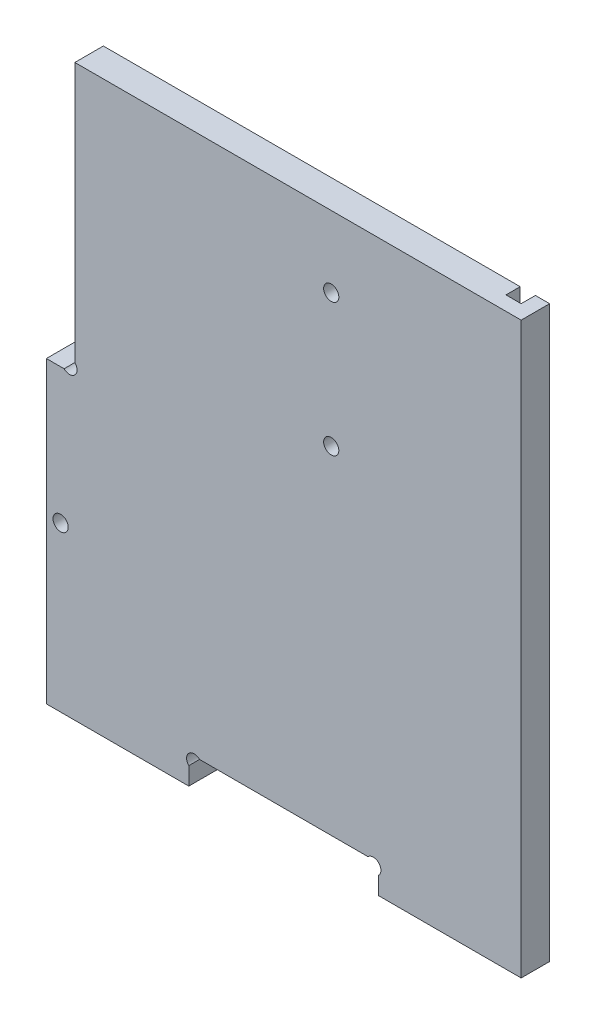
SolidWorks part; units mm, degrees
ref_plane "Plan de face" through (0, 0, 0) normal (0, 0, 1) x (1, 0, 0)
ref_plane "Plan de dessus" through (0, 0, 0) normal (0, 1, 0) x (1, 0, 0)
ref_plane "Plan de droite" through (0, 0, 0) normal (1, 0, 0) x (0, 0, -1)
sketch "Esquisse1" plane through (0, 0, 0) normal (0, 0, 1) x (1, 0, 0)
  line L0 (82.3705, 0) -> (-56.1865, 0) construction
  line L1 (82.3705, 114) -> (-56.1865, 114) construction
  line L2 (0, -4.9573) -> (0, 135.3236) construction
  line L3 (50, -15.4988) -> (50, 141.2736) construction
  line L4 (-50, -15.4988) -> (-50, 141.2736) construction
  line L5 (44, 39.1377) -> (44, 121.3123) construction
  line L6 (72.3333, 57) -> (33.1212, 57) construction
  line L7 (-44, 114) -> (50, 114)
  line L8 (50, 114) -> (50, -6)
  line L9 (10, 127.8381) -> (10, 66.9948) construction
  line L13 (-50, 57) -> (-50, -6)
  line L14 (-46.2627, 57) -> (-50, 57)
  line L15 (-44, 59.2627) -> (-44, 114)
  line L16 (20, 0) -> (7.0535, -12.9465) construction
  line L17 (63.8235, 64) -> (-3.5822, 64) construction
  line L18 (23.0372, 71) -> (-3.5822, 71) construction
  line L19 (33.1212, 99) -> (-3.5822, 99) construction
  line L20 (44, 57) -> (55.7507, 68.7507) construction
  line L21 (7.0535, 85) -> (23.0372, 85) construction
  line L24 (82.3705, -6) -> (-56.1865, -6) construction
  line L25 (20, 1.6152) -> (20, -15.4988) construction
  line L26 (50, -6) -> (20, -6)
  line L27 (20, -6) -> (20, -2.2627)
  line L28 (17.7373, 0) -> (-17.7373, 0)
  line L29 (-20, -2.2627) -> (-20, -6)
  line L30 (-20, -6) -> (-50, -6)
  circle A2 centre (10, 71) radius 1.6
  circle A3 centre (10, 99) radius 1.6
  circle A6 centre (10, 99) radius 10.5 construction
  arc A9 (-44, 59.2627) -> (-46.2627, 57) centre (-45.1314, 58.1314) cw
  circle A10 centre (-47, 28.5) radius 1.6
  arc A11 (20, -2.2627) -> (17.7373, 0) centre (18.8686, -1.1314) ccw
  arc A12 (-20, -2.2627) -> (-17.7373, 0) centre (-18.8686, -1.1314) cw
  dimension "D8" = 7
  dimension "D11" = 45
  dimension "D12" = 14
  dimension "D14" = 10
  dimension "D15" = 6
  dimension "D1" = 114
  dimension "D2" = 50
  dimension "D3" = 100
  dimension "D4" = 57
  dimension "D5" = 6
  dimension "D9" = 50
  dimension "D10" = 28
  dimension "D16" = 30
  dimension "D17" = 45
extrude "Boss.-Extru.1" add sketch "Esquisse1" along normal blind 6
sketch "Esquisse2" plane through (0, 0, 0) normal (0, 0, -1) x (-1, 0, 0)
  line L0 (-7.2901, 99) -> (-38.9304, 99) construction
  line L1 (-10, 122.2845) -> (-10, 66.2315) construction
  line L2 (-17.5, 122.2845) -> (-17.5, 92.411) construction
  circle A0 centre (-17.5, 99) radius 1.1
  circle A1 centre (-2.5, 99) radius 1.1
  circle A3 centre (-10, 78.5) radius 1.1
  circle A5 centre (-10, 63.5) radius 1.1
  point P21 (-10, 71)
  dimension "D1" = 7.5
extrude "Enlèv. mat.-Extru.1" cut sketch "Esquisse2" against normal blind 1
sketch "Esquisse3" plane through (0, 0, 0) normal (0, 0, -1) x (-1, 0, 0)
  line L0 (-50, -14.7138) -> (-50, 138.1803) construction
  line L1 (-47, 128.5034) -> (-47, -14.7138) construction
  line L2 (-43.8, 138.1803) -> (-43.8, -14.7138) construction
  line L4 (-47, 116.0311) -> (-43.8, 116.0311)
  line L5 (-47, 116.0311) -> (-47, -9.3378)
  line L6 (-47, -9.3378) -> (-43.8, -9.3378)
  line L7 (-43.8, 116.0311) -> (-43.8, -9.3378)
  dimension "D1" = 3
  dimension "D2" = 6.2
extrude "Enlèv. mat.-Extru.2" cut sketch "Esquisse3" against normal blind 3
